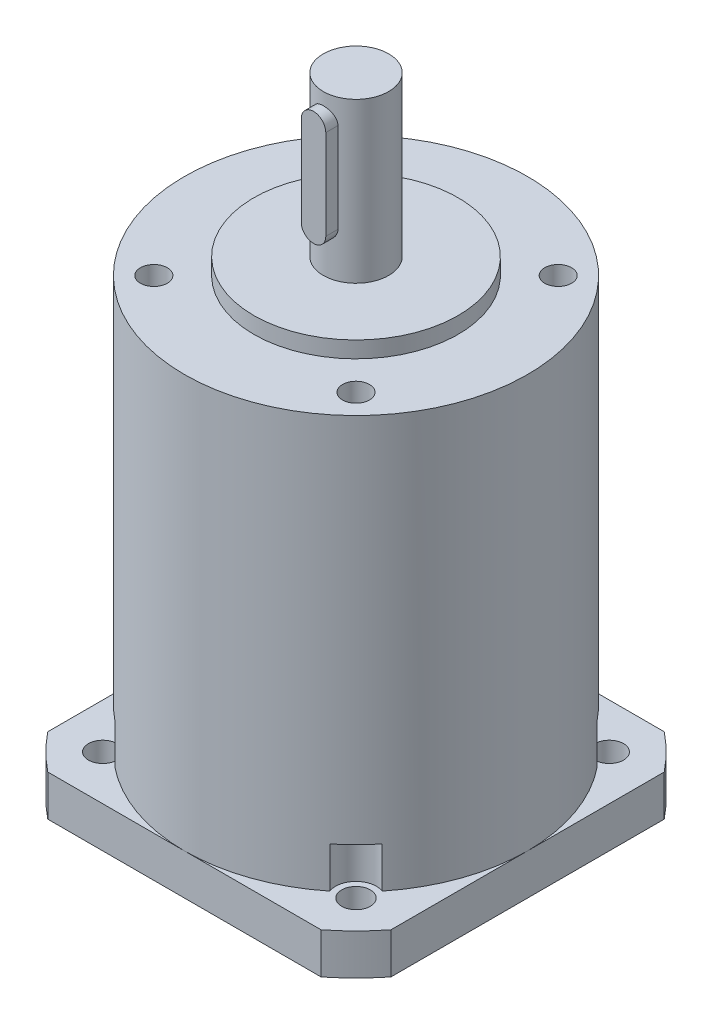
SolidWorks part; units mm, degrees
ref_plane "前视" through (0, 0, 0) normal (0, 0, 1) x (1, 0, 0)
ref_plane "上视" through (0, 0, 0) normal (0, 1, 0) x (1, 0, 0)
ref_plane "右视" through (0, 0, 0) normal (1, 0, 0) x (0, 0, -1)
sketch "草图1" plane through (0, 0, 0) normal (0, 1, 0) x (1, 0, 0)
  circle A0 centre (0, 0) radius 21
  dimension "D1" = 42
extrude "凸台-拉伸1" add sketch "草图1" along normal blind 50.5
ref_plane "基准面1" through (0, 50.5, 0) normal (0, 1, 0) x (1, 0, 0)
sketch "草图2" plane through (0, 50.5, 0) normal (0, 1, 0) x (1, 0, 0)
  circle A0 centre (0, 0) radius 12.5
  dimension "D1" = 25
extrude "凸台-拉伸2" add sketch "草图2" along normal blind 2
sketch "草图3" plane through (0, 50.5, 0) normal (0, 1, 0) x (1, 0, 0)
  circle A0 centre (0, 0) radius 4
  dimension "D1" = 8
extrude "凸台-拉伸3" add sketch "草图3" along normal blind 21.5
sketch "草图4" plane through (0, 50.5, 0) normal (0, 1, 0) x (1, 0, 0)
  point P4 (12.3744, -12.3744)
  point P5 (12.3744, 12.3744)
  point P6 (-12.3744, -12.3744)
  point P7 (-12.3744, 12.3744)
  point P8 (0, 0)
  dimension "D1" = 4
hole_wizard "M4 螺纹孔1" positions "草图6" profile "草图5" tap size "M4" standard "ISO"
sketch "草图6" plane through (0, 50.5, 0) normal (0, 1, 0) x (1, 0, 0)
  point P0 (-12.3744, 12.3744)
  point P3 (-12.3744, -12.3744)
  point P6 (12.3744, -12.3744)
  point P9 (12.3744, 12.3744)
sketch "草图5" plane through (-12.3744, 50.5, -12.3744) normal (1, 0, 0) x (0, 0, 1)
  line L0 (0, 0) -> (0, 9.9914)
  line L1 (0, 9.9914) -> (1.65, 9)
  line L2 (1.65, 9) -> (1.65, 0)
  line L5 (1.65, 0) -> (0, 0)
  line L10 (0, 9.9914) -> (-1.65, 9) construction
  line L11 (0, -6.35) -> (0, 107.95) construction
  dimension "螺纹孔钻头直径" = 3.3
  dimension "螺纹孔钻头深度" = 9
  dimension "导头角度" = 118
ref_plane "基准面2" through (0, 0, 2.2) normal (0, 0, 1) x (1, 0, 0)
sketch "草图7" plane through (0, 0, 2.2) normal (0, 0, 1) x (1, 0, 0)
  line L4 (-1.5, 69) -> (-1.5, 58)
  line L6 (1.5, 69) -> (1.5, 58)
  line L7 (-1.5, 69) -> (1.5, 58) construction
  line L8 (-1.5, 58) -> (1.5, 69) construction
  arc A0 (-1.5, 69) -> (1.5, 69) centre (0, 69) cw
  arc A1 (-1.5, 58) -> (1.5, 58) centre (0, 58) ccw
  point P0 (0, 63.5)
  dimension "D1" = 1.5
  dimension "D2" = 1.5
extrude "凸台-拉伸4" add sketch "草图7" along normal blind 3
sketch "草图8" plane through (0, 0, 0) normal (0, 1, 0) x (1, 0, 0)
  line L1 (-21, -21) -> (21, -21)
  line L2 (-21, -21) -> (-21, 21)
  line L3 (-21, 21) -> (21, 21)
  line L4 (21, -21) -> (21, 21)
  line L5 (-21, -21) -> (21, 21) construction
  line L6 (-21, 21) -> (21, -21) construction
  point P0 (0, 0)
extrude "凸台-拉伸5" add sketch "草图8" against normal blind 5
sketch "草图10" plane through (0, 0, 0) normal (0, 1, 0) x (1, 0, 0)
  circle A0 centre (0, 0) radius 26.85
  circle A1 centre (0, 0) radius 30.2655
  dimension "D1" = 53.7
  dimension "D2" = 60.5311
extrude "切除-拉伸2" cut sketch "草图10" against normal blind 5.5
ref_plane "基准面3" through (0, -5, 0) normal (0, -1, 0) x (-1, 0, 0)
sketch "草图11" plane through (0, -5, 0) normal (0, -1, 0) x (-1, 0, 0)
  circle A0 centre (0, 0) radius 11
  dimension "D1" = 22
extrude "切除-拉伸3" cut sketch "草图11" against normal blind 2.5
sketch "草图12" plane through (0, -5, 0) normal (0, -1, 0) x (-1, 0, 0)
  circle A0 centre (0, 0) radius 2.5
  dimension "D1" = 5
extrude "切除-拉伸4" cut sketch "草图12" against normal blind 10
sketch "草图13" plane through (0, -5, 0) normal (0, -1, 0) x (-1, 0, 0)
  circle A0 centre (-15.5, -15.5) radius 1.75
  circle A1 centre (-15.5, 15.5) radius 1.75
  circle A2 centre (15.5, 15.5) radius 1.75
  circle A3 centre (15.5, -15.5) radius 1.75
  point P12 (0, 0)
  dimension "D1" = 3.5
  dimension "D2" = 4
extrude "切除-拉伸5" cut sketch "草图13" against normal blind 10
sketch "草图14" plane through (0, 0, 0) normal (0, 1, 0) x (1, 0, 0)
  circle A0 centre (15.5, -15.5) radius 2.5
  circle A1 centre (-15.5, -15.5) radius 2.5
  circle A2 centre (-15.5, 15.5) radius 2.5
  circle A3 centre (15.5, 15.5) radius 2.5
  point P12 (0, 0)
  dimension "D1" = 5
  dimension "D2" = 4
extrude "切除-拉伸6" cut sketch "草图14" along normal blind 5
